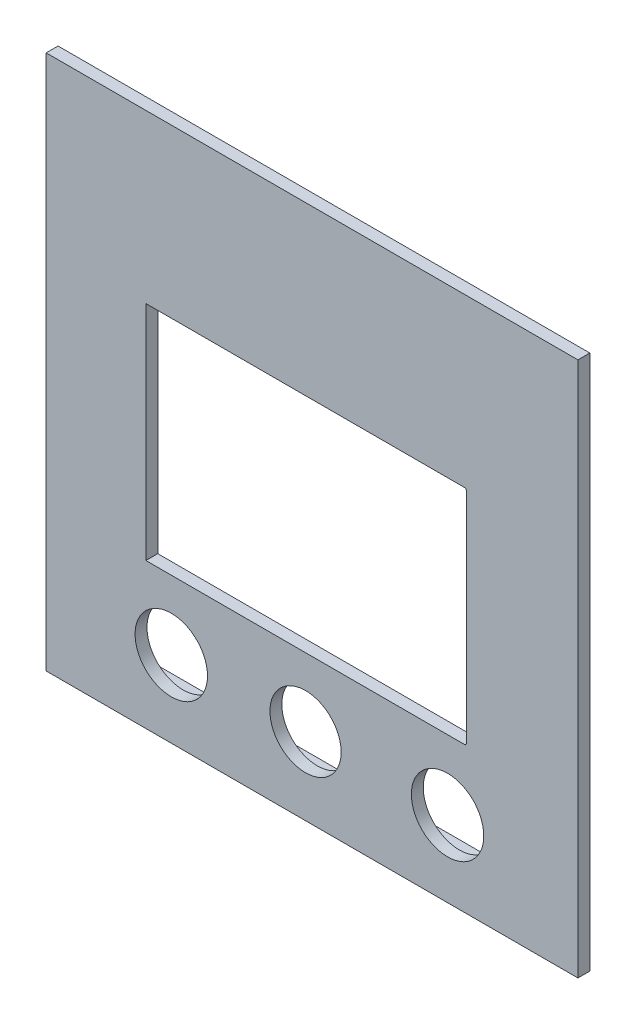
SolidWorks part; units mm, degrees
ref_plane "Front Plane" through (0, 0, 0) normal (0, 0, 1) x (1, 0, 0)
ref_plane "Top Plane" through (0, 0, 0) normal (0, 1, 0) x (1, 0, 0)
ref_plane "Right Plane" through (0, 0, 0) normal (1, 0, 0) x (0, 0, -1)
sketch "Sketch1" plane through (0, 0, 0) normal (0, 0, 1) x (1, 0, 0)
  line L0 (-70.1557, -86.9276) -> (-70.1557, -84.3959)
  line L1 (-108.975, -18.2442) -> (-27.375, -18.2442)
  line L2 (-108.975, -18.2442) -> (-108.975, -100.4442)
  line L3 (-108.975, -100.4442) -> (-27.375, -100.4442)
  line L4 (-27.375, -18.2442) -> (-27.375, -100.4442)
  line L5 (-96.375, -42.6242) -> (-42.375, -42.6242) construction
  line L6 (-96.375, -42.6242) -> (-96.375, -79.7242) construction
  line L7 (-96.375, -79.7242) -> (-42.375, -79.7242) construction
  line L8 (-42.375, -42.6242) -> (-42.375, -79.7242) construction
  line L9 (-70.1557, -99.3645) -> (-68.7812, -99.3645)
  line L10 (-70.1557, -99.3645) -> (-70.1557, -96.8327)
  line L11 (-70.1557, -84.3959) -> (-68.7812, -84.3959)
  line L12 (-68.7812, -99.3645) -> (-68.7812, -96.8327)
  line L13 (-70.1557, -99.3645) -> (-69.9256, -96.8592) construction
  line L14 (-70.1557, -84.3959) -> (-69.9256, -86.9011) construction
  line L15 (-77.0359, -92.5819) -> (-74.4189, -92.5819)
  line L17 (-77.0359, -91.1784) -> (-74.4189, -91.1784)
  line L19 (-77.0366, -92.5751) -> (-74.4475, -92.3374) construction
  line L20 (-42.175, -42.4242) -> (-96.575, -42.4242)
  line L21 (-96.575, -42.4242) -> (-96.575, -79.9242)
  line L22 (-96.575, -79.9242) -> (-42.175, -79.9242)
  line L23 (-42.175, -79.9242) -> (-42.175, -42.4242)
  line L24 (-77.0366, -91.1852) -> (-74.4475, -91.423) construction
  line L25 (-69.5599, -90.8844) -> (-69.377, -92.876) construction
  line L26 (-69.0112, -86.9011) -> (-68.7812, -84.3959) construction
  line L27 (-68.7812, -86.9276) -> (-68.7812, -84.3959)
  line L28 (-70.1808, -91.1784) -> (-68.756, -91.1784)
  line L29 (-70.4642, -91.7887) -> (-68.4726, -91.9716) construction
  line L30 (-70.4642, -91.9716) -> (-68.4726, -91.7887) construction
  line L31 (-70.1808, -92.5819) -> (-68.756, -92.5819)
  line L32 (-64.5179, -91.1784) -> (-61.9009, -91.1784)
  line L33 (-64.4894, -91.423) -> (-61.9003, -91.1852) construction
  line L34 (-64.4894, -92.3374) -> (-61.9003, -92.5751) construction
  line L35 (-64.5179, -92.5819) -> (-61.9009, -92.5819)
  line L36 (-68.7812, -92.6066) -> (-68.7812, -91.1538)
  line L37 (-69.0112, -96.8592) -> (-68.7812, -99.3645) construction
  line L38 (-69.5599, -92.876) -> (-69.377, -90.8844) construction
  line L39 (-70.1557, -92.6066) -> (-70.1557, -91.1538)
  circle A0 centre (-91.8933, -91.5775) radius 6.1
  circle A1 centre (-45.3451, -91.6535) radius 6.1
  arc A2 (-76.4331, -91.1784) -> (-76.4391, -91.2401) centre (-69.4684, -91.8802) ccw
  arc A3 (-74.4189, -91.1784) -> (-74.4189, -92.5819) centre (-69.4684, -91.8802) ccw
  arc A4 (-75.4272, -91.1784) -> (-75.4433, -91.3315) centre (-69.4684, -91.8802) ccw
  circle A5 centre (-69.4684, -91.8802) radius 1
  arc A6 (-77.0359, -91.1784) -> (-77.0359, -92.5819) centre (-69.4684, -91.8802) ccw
  circle A7 centre (-69.4684, -91.8802) radius 5 construction
  circle A8 centre (-69.4684, -91.8802) radius 6 construction
  circle A9 centre (-69.4684, -91.8802) radius 7 construction
  circle A10 centre (-69.4684, -91.8802) radius 7.6 construction
  arc A11 (-68.7812, -86.9276) -> (-70.1557, -86.9276) centre (-69.4684, -91.8802) ccw
  arc A14 (-64.5179, -92.5819) -> (-64.5179, -91.1784) centre (-69.4684, -91.8802) ccw
  arc A15 (-63.5096, -92.5819) -> (-63.4936, -92.4288) centre (-69.4684, -91.8802) ccw
  arc A16 (-62.5037, -92.5819) -> (-62.4977, -92.5203) centre (-69.4684, -91.8802) ccw
  arc A17 (-61.9009, -92.5819) -> (-61.9009, -91.1784) centre (-69.4684, -91.8802) ccw
  arc A18 (-70.1557, -96.8327) -> (-68.7812, -96.8327) centre (-69.4684, -91.8802) ccw
  arc A21 (-75.4433, -92.4288) -> (-75.4272, -92.5819) centre (-69.4684, -91.8802) ccw
  arc A22 (-76.4391, -92.5203) -> (-76.4331, -92.5819) centre (-69.4684, -91.8802) ccw
  arc A23 (-63.4936, -91.3315) -> (-63.5096, -91.1784) centre (-69.4684, -91.8802) ccw
  arc A24 (-62.4977, -91.2401) -> (-62.5037, -91.1784) centre (-69.4684, -91.8802) ccw
  dimension "D1" = 12.2
  dimension "D2" = 12.2
  dimension "D5" = 2
  dimension "D6" = 10
  dimension "D3" = 2
  dimension "D4" = 1
  dimension "D8" = 0.6
extrude "Boss-Extrude1" add sketch "Sketch1" along normal blind 2 contours L4 L1 L2 L3 A17 L35 A14 L32 A6 L17 A3 L15 A5 A1 A0 L23 L22 L21 L20 L27 A11 L0 L11 L10 A18 L12 L9
fillet "Fillet1" radius 0.3 4 edges at (-96.575, -79.9242, 1) (-42.175, -79.9242, 1) (-42.175, -42.4242, 1) (-96.575, -42.4242, 1)
sketch "Sketch2" plane through (0, 0, 0) normal (0, 0, -1) x (-1, 0, 0)
  line L1 (27.375, -18.2442) -> (108.975, -18.2442) construction
  line L2 (27.375, -18.2442) -> (27.375, -100.4442) construction
  line L3 (27.375, -100.4442) -> (108.975, -100.4442) construction
  line L4 (108.975, -18.2442) -> (108.975, -100.4442) construction
  line L8 (107.775, -19.4442) -> (107.775, -99.2442)
  line L9 (28.575, -99.2442) -> (107.775, -99.2442)
  line L10 (28.575, -19.4442) -> (28.575, -99.2442)
  line L11 (28.575, -19.4442) -> (107.775, -19.4442)
  line L12 (27.175, -18.0442) -> (27.175, -100.6442)
  line L13 (27.175, -100.6442) -> (109.175, -100.6442)
  line L14 (109.175, -100.6442) -> (109.175, -18.0442)
  line L15 (109.175, -18.0442) -> (27.175, -18.0442)
  line L16 (27.175, -18.0442) -> (27.175, -100.6442)
  line L17 (27.175, -100.6442) -> (109.175, -100.6442)
  line L18 (109.175, -100.6442) -> (109.175, -18.0442)
  line L19 (109.175, -18.0442) -> (27.175, -18.0442)
  dimension "D1" = 0.2
  dimension "D2" = 1.2
extrude "Boss-Extrude2" add sketch "Sketch2" along normal blind 3
sketch "Sketch3" plane through (0, 0, 2) normal (0, 0, 1) x (1, 0, 0)
  circle A0 centre (-69.275, -91.4442) radius 6
extrude "Cut-Extrude1" cut sketch "Sketch3" against normal blind 3
sketch "Sketch4" plane through (0, 0, 2) normal (0, 0, 1) x (1, 0, 0)
  circle A0 centre (-69.275, -91.4442) radius 6
  circle A1 centre (-69.275, -91.4442) radius 8.1771
extrude "Boss-Extrude3" add sketch "Sketch4" against normal up to surface (2 mm away)
sketch "Sketch5" plane through (0, 0, 2) normal (0, 0, 1) x (1, 0, 0)
  line L0 (-112.975, -14.2442) -> (-112.975, -104.4442)
  line L1 (-108.975, -18.2442) -> (-27.375, -18.2442)
  line L2 (-108.975, -18.2442) -> (-108.975, -100.4442)
  line L3 (-108.975, -100.4442) -> (-27.375, -100.4442)
  line L4 (-27.375, -18.2442) -> (-27.375, -100.4442)
  line L5 (-112.975, -104.4442) -> (-23.375, -104.4442)
  line L6 (-23.375, -14.2442) -> (-23.375, -104.4442)
  line L7 (-112.975, -14.2442) -> (-23.375, -14.2442)
  dimension "D1" = 4
extrude "Boss-Extrude4" add sketch "Sketch5" against normal blind 2
sketch "Sketch6" plane through (0, 0, 2) normal (0, 0, 1) x (1, 0, 0)
  line L0 (-42.475, -42.4242) -> (-96.275, -42.4242) construction
  line L1 (-96.175, -42.4242) -> (-96.8293, -42.4242)
  line L2 (-96.175, -42.4242) -> (-96.175, -80.5379)
  line L3 (-96.175, -80.5379) -> (-96.8293, -80.5379)
  line L4 (-96.8293, -42.4242) -> (-96.8293, -80.5379)
  line L5 (-96.175, -79.5242) -> (-96.175, -42.4242) construction
extrude "Boss-Extrude5" add sketch "Sketch6" against normal blind 2
